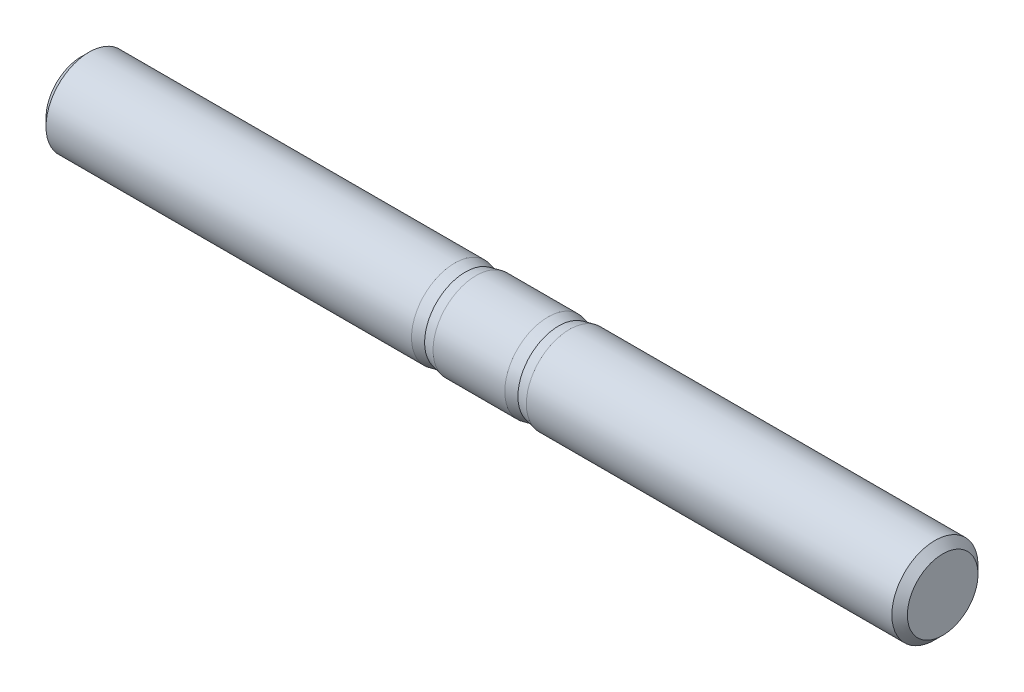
SolidWorks part; units mm, degrees
ref_plane "Front" through (0, 0, 0) normal (0, 0, 1) x (1, 0, 0)
ref_plane "Top" through (0, 0, 0) normal (0, 1, 0) x (1, 0, 0)
ref_plane "Right" through (0, 0, 0) normal (1, 0, 0) x (0, 0, -1)
sketch "Sketch1" plane through (0, 0, 0) normal (0, 0, 1) x (1, 0, 0)
  line L0 (-1.3108, 0) -> (30.3862, 0) construction
  line L1 (0, 0) -> (0, 1.5)
  line L2 (0, 1.5) -> (13, 1.5)
  line L3 (13, 1.5) -> (13.75, 1.3375)
  line L4 (13.75, 1.3375) -> (16.25, 1.3375)
  line L5 (16.25, 1.3375) -> (17, 1.5)
  line L6 (17, 1.5) -> (30, 1.5)
  line L7 (30, 1.5) -> (30, 0)
  line L8 (30, 0) -> (0, 0)
revolve "Base" add sketch "Sketch1" angle 360 about L0
chamfer "HeadChamfer" distance 0.2705 angle 45 2 edges at (0, 0, 1.5) (30, 0, 1.5)
sketch "Sketch4" plane through (0, 0, 0) normal (0, 0, 1) x (1, 0, 0)
  line L0 (13, 1.3375) -> (13.75, 1.5)
  line L1 (13, 1.5) -> (13, -1.5) construction
  line L2 (13.75, 1.5) -> (16.25, 1.5)
  line L3 (16.25, 1.5) -> (17, 1.3375)
  line L4 (17, 1.5) -> (17, -1.5) construction
  line L5 (17, 1.3375) -> (13, 1.3375)
  line L6 (-7.8091, 0) -> (106.8365, 0) construction
  line L8 (13.75, 35.0577) -> (13.75, -32.0577) construction
  line L10 (13.75, 1.3375) -> (13.75, -1.3375) construction
  line L11 (13.75, 1.3375) -> (16.25, 1.3375) construction
revolve "BaseBody" add sketch "Sketch4" angle 360 about L6
sketch "Sketch2" plane through (0, 0, 0) normal (0, 0, 1) x (1, 0, 0)
  line L0 (29.7295, 1.2657) -> (29.8648, 1.5)
  line L1 (29.8648, 1.5) -> (29.8648, 2)
  line L2 (29.8648, 2) -> (29.5943, 2)
  line L3 (29.5943, 2) -> (29.5943, 1.5)
  line L4 (29.5943, 1.5) -> (29.7295, 1.2657)
  line L5 (0, 0) -> (114.8799, 0) construction
  line L6 (29.7295, 1.5) -> (29.7295, -1.5) construction
revolve "Cut-Revolve10" [suppressed] cut sketch "Sketch2" angle 360 about L5
pattern_linear "LPattern10" [suppressed] count 40 spacing 0.3246 along (1, 0, 0)
sketch "Sketch3" plane through (0, 0, 0) normal (0, 0, 1) x (1, 0, 0)
  line L0 (0.2705, 1.2657) -> (0.4057, 1.5)
  line L1 (0.4057, 1.5) -> (0.4057, 2)
  line L2 (0.4057, 2) -> (0.1352, 2)
  line L3 (0.1352, 2) -> (0.1352, 1.5)
  line L4 (0.1352, 1.5) -> (0.2705, 1.2657)
  line L5 (0, 0) -> (15.3216, 0) construction
  line L6 (0, 1.2295) -> (0, -1.2295) construction
  line L7 (0.2705, 1.5) -> (0.2705, -1.5) construction
revolve "Cut-Revolve11" [suppressed] cut sketch "Sketch3" angle 360 about L5
pattern_linear "LPattern11" [suppressed] count 40 spacing 0.3246 along (1, 0, 0)
equation "\"D2@Sketch1\" = \"X@Sketch1\""
equation "\"D2@ThreadCosmetic2\" = \"D2@ThreadCosmetic1\""
equation "\"b@ThreadCosmetic2\" = \"b@Sketch1\""
equation "\"D1@HeadChamfer\" =  ( \"d@Sketch1\" - \"D2@ThreadCosmetic1\" )  / 2"
equation "\"D1@Sketch1\" = \"b@Sketch1\""
equation "\"D5@Sketch2\" = \"d@Sketch1\""
equation "\"D4@Sketch2\" =  ( \"d@Sketch1\" - \"D2@ThreadCosmetic2\" )  / 2"
equation "\"D3@LPattern10\" = \"D4@Sketch2\" * 1.2"
equation "\"D1@LPattern10\" = \"b@ThreadCosmetic2\" / \"D3@LPattern10\""
equation "\"D3@Sketch3\" = \"d@Sketch1\""
equation "\"D5@Sketch3\"  =  ( \"d@Sketch1\" - \"D2@ThreadCosmetic1\" )  / 2"
equation "\"D3@LPattern11\" = \"D5@Sketch3\" * 1.2"
equation "\"D1@LPattern11\" = \"D1@ThreadCosmetic1\" / \"D3@LPattern11\""
equation "\"D1@ThreadCosmetic1\" = \"b@Sketch1\""
